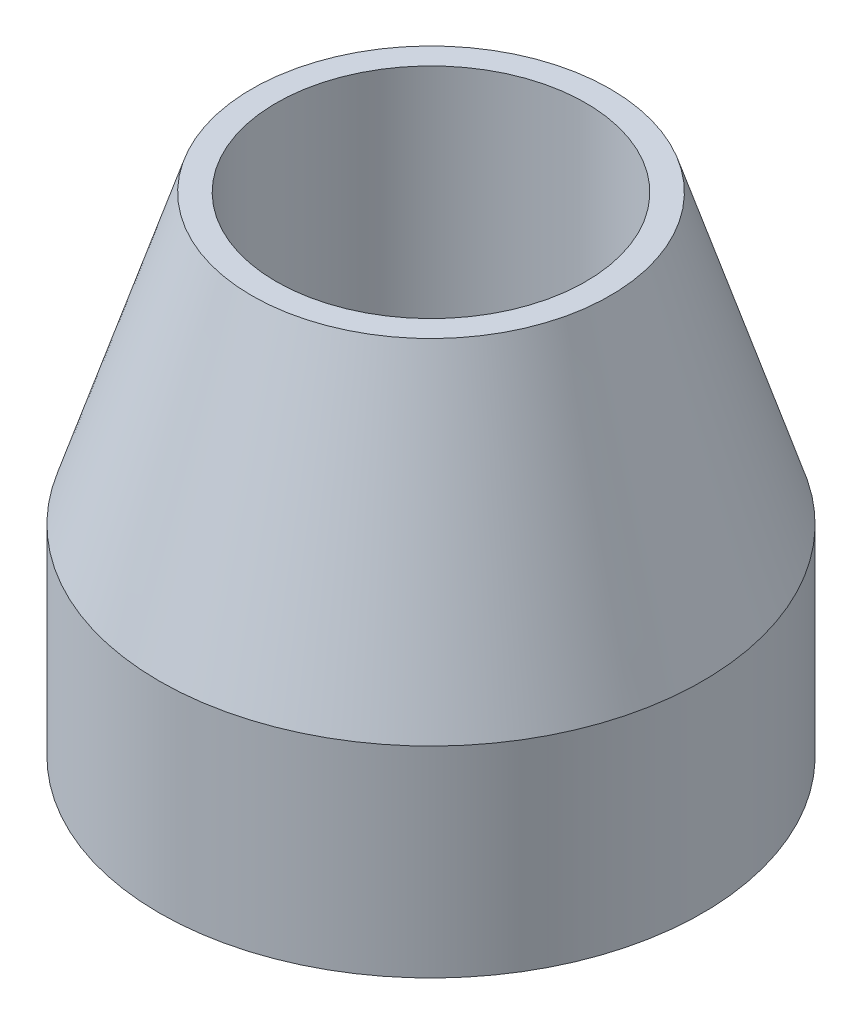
SolidWorks part; units mm, degrees
ref_plane "Plan1" through (0, 0, 0) normal (0, 0, 1) x (1, 0, 0)
ref_plane "Plan2" through (0, 0, 0) normal (0, 1, 0) x (1, 0, 0)
ref_plane "Plan3" through (0, 0, 0) normal (1, 0, 0) x (0, 0, -1)
sketch "Esquisse1" plane through (0, 0, 0) normal (0, 0, 1) x (1, 0, 0)
  line L0 (524.8412, 60.4657) -> (524.8412, 42.2427) construction
  line L1 (519.3568, 60.4657) -> (519.3568, 43.1561)
  line L140 (515.2157, 43.1561) -> (519.3568, 43.1561)
  line L141 (515.2157, 50.2741) -> (518.4916, 60.4657)
  line L145 (515.2157, 50.2741) -> (515.2157, 43.1561)
  line L147 (518.4916, 60.4657) -> (519.3568, 60.4657)
  dimension "D1" = 5.4844
revolve "Base-Révolution" add sketch "Esquisse1" angle 360 about L0
